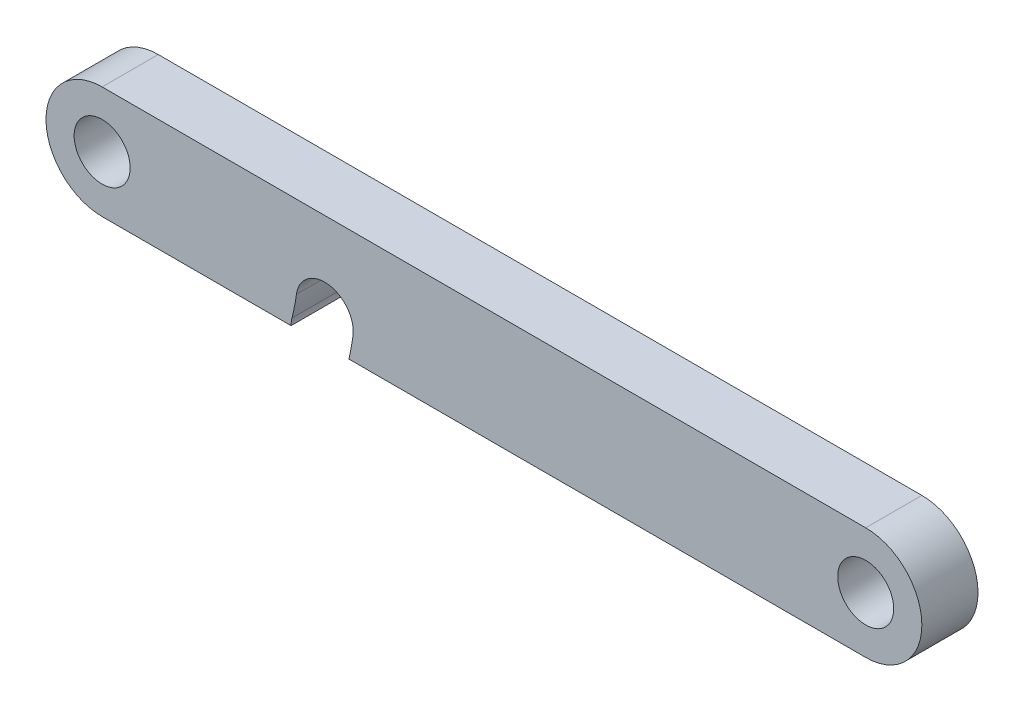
SolidWorks part; units mm, degrees
ref_plane "Front Plane" through (0, 0, 0) normal (0, 0, 1) x (1, 0, 0)
ref_plane "Top Plane" through (0, 0, 0) normal (0, 1, 0) x (1, 0, 0)
ref_plane "Right Plane" through (0, 0, 0) normal (1, 0, 0) x (0, 0, -1)
sketch "Sketch1" plane through (0, 0, 0) normal (0, 0, 1) x (1, 0, 0)
  line L0 (-21.59, 0) -> (21.59, 0) construction
  line L1 (-21.59, 3.175) -> (21.59, 3.175)
  line L2 (-21.59, -3.175) -> (21.59, -3.175)
  arc A0 (-21.59, 3.175) -> (-21.59, -3.175) centre (-21.59, 0) ccw
  arc A1 (21.59, -3.175) -> (21.59, 3.175) centre (21.59, 0) ccw
  circle A2 centre (21.59, 0) radius 1.5842
  circle A3 centre (-21.59, 0) radius 1.5842
  point P2 (0, 0)
  dimension "D3" = 3.1684
  dimension "D4" = 3.1684
  dimension "D1" = 6.35
  dimension "D2" = 43.18
extrude "Boss-Extrude1" add sketch "Sketch1" along normal mid plane 3.175
sketch "Sketch3" plane through (0, 0, 0) normal (0, 0, 1) x (1, 0, 0)
  line L1 (-21.59, -3.175) -> (21.59, -3.175) construction
  circle A0 centre (-21.59, 0) radius 12.7 construction
  arc A1 (-9.2933, -3.175) -> (-9.0047, -1.7031) centre (-21.59, 0) ccw construction
  arc A6 (-7.7316, -3.5782) -> (-7.4064, -1.9194) centre (-21.59, 0) ccw
  arc A7 (-10.855, -2.7718) -> (-10.603, -1.4868) centre (-21.59, 0) ccw
  arc A8 (-10.855, -2.7718) -> (-7.7316, -3.5782) centre (-9.2933, -3.175) ccw
  arc A9 (-7.4064, -1.9194) -> (-10.603, -1.4868) centre (-9.0047, -1.7031) ccw
  point P7 (-9.1272, -2.4433)
  dimension "D1" = 25.4
  dimension "Sketch3" = 3.2258
extrude "Cut-Extrude1" cut sketch "Sketch3" against normal through all both and the other way through all
